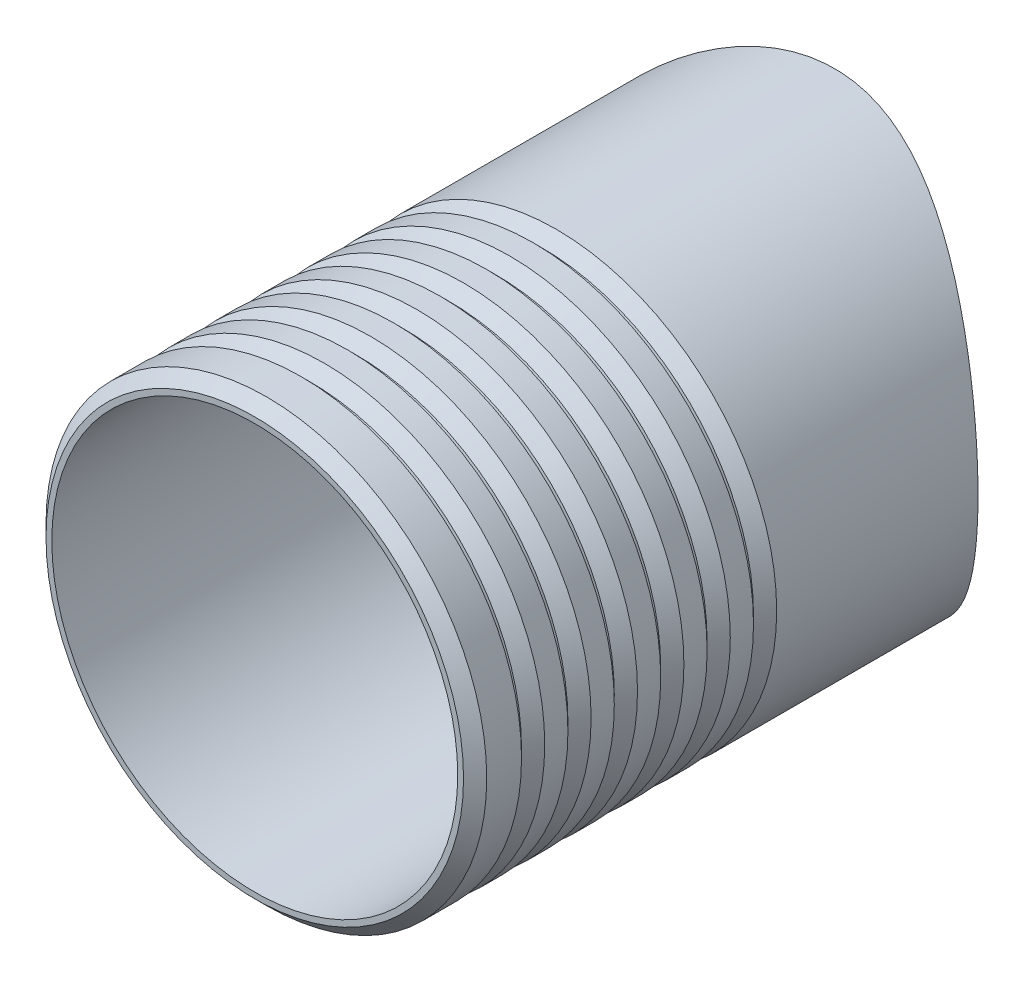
SolidWorks part; units mm, degrees
ref_plane "Plan de face" through (0, 0, 0) normal (0, 0, 1) x (1, 0, 0)
ref_plane "Plan de dessus" through (0, 0, 0) normal (0, 1, 0) x (1, 0, 0)
ref_plane "Plan de droite" through (0, 0, 0) normal (1, 0, 0) x (0, 0, -1)
sketch "Esquisse1" plane through (0, 0, 0) normal (0, 0, 1) x (1, 0, 0)
  circle A0 centre (0, 0) radius 38
  circle A1 centre (0, 0) radius 35
  dimension "D1" = 70
  dimension "D2" = 76
extrude "Extrusion1" add sketch "Esquisse1" along normal blind 100
sketch "Esquisse2" plane through (0, 0, 0) normal (1, 0, 0) x (0, 0, -1)
  circle A0 centre (47.7179, 0) radius 61
  dimension "D1" = 122
extrude "Extrusion2" cut sketch "Esquisse2" against normal through all and the other way through all
chamfer "Chanfrein1" distance 2 angle 45 1 edges at (38, 0, 100)
sketch "Esquisse3" plane through (0, 0, 0) normal (1, 0, 0) x (0, 0, -1)
  line L0 (-92, 38) -> (-88, 38)
  line L1 (-88, 38) -> (-90.5, 36.5)
  line L2 (-90.5, 36.5) -> (-92, 36.5)
  line L3 (-92, 36.5) -> (-92, 38)
  line L4 (0, 38) -> (-98, 38) construction
  line L5 (-100, 36) -> (-100, -36) construction
  dimension "D1" = 1.5
  dimension "D2" = 4
  dimension "D3" = 1.5
  dimension "D4" = 8
revolve "Enlèvement de matière-Révolution1" cut sketch "Esquisse3" angle 360 about axis through (0, 0, 100) along (0, 0, -1)
pattern_linear "Répétition linéaire1" count 6 spacing 8 along (0, 0, -1) of "Enlèvement de matière-Révolution1"
